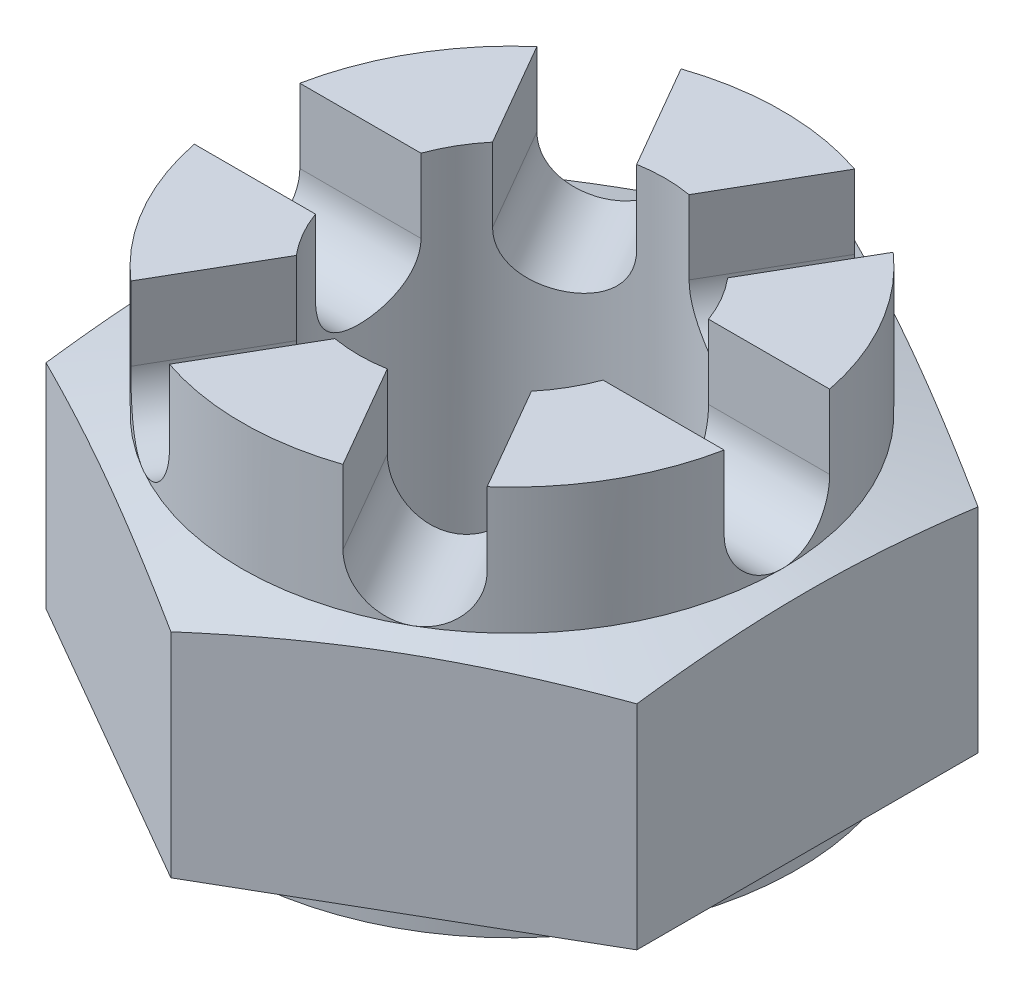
SolidWorks part; units mm, degrees
ref_plane "Спереди" through (0, 0, 0) normal (0, 0, 1) x (1, 0, 0)
ref_plane "Сверху" through (0, 0, 0) normal (0, 1, 0) x (1, 0, 0)
ref_plane "Справа" through (0, 0, 0) normal (1, 0, 0) x (0, 0, -1)
sketch "Эскиз1" plane through (0, 0, 0) normal (0, 1, 0) x (1, 0, 0)
  line L1 (0, 6.4158) -> (-5.5563, 3.2079)
  line L2 (-5.5563, 3.2079) -> (-5.5563, -3.2079)
  line L3 (-5.5563, -3.2079) -> (0, -6.4158)
  line L4 (0, -6.4158) -> (5.5562, -3.2079)
  line L5 (5.5562, -3.2079) -> (5.5562, 3.2079)
  line L6 (5.5562, 3.2079) -> (0, 6.4158)
  circle A0 centre (0, 0) radius 2.8804
  circle A1 centre (0, 0) radius 5.5563 construction
  dimension "D1" = 5.7607
  dimension "D2" = 11.1125
extrude "Бобышка-Вытянуть1" add sketch "Эскиз1" along normal blind 7.1437
sketch "Эскиз2" plane through (0, 0, 0) normal (1, 0, 0) x (0, 0, -1)
  line L0 (0, 0) -> (0, 12.1137) construction
  line L1 (6.4158, 7.1437) -> (3.2079, 7.1437) construction
  line L2 (6.4158, 0) -> (5.3578, 0)
  line L3 (6.4158, 0) -> (6.4158, 0.3969)
  line L4 (6.4158, 0.3969) -> (5.3578, 0.3969)
  line L5 (5.3578, 0) -> (5.3578, 0.3969)
  line L6 (6.4158, 7.1437) -> (5.08, 7.1437)
  line L7 (6.4158, 7.1437) -> (6.4158, 4.4046)
  line L8 (6.4158, 4.4046) -> (5.08, 4.7625)
  line L9 (5.08, 7.1437) -> (5.08, 4.7625)
  line L10 (-3.2079, 0) -> (3.2079, 0) construction
  line L11 (6.4158, 7.1437) -> (6.4158, 0) construction
  dimension "D1" = 0.3969
  dimension "D2" = 10.16
  dimension "D3" = 2.3813
  dimension "D4" = 15
  dimension "D5" = 10.7156
revolve "Вырез-Повернуть1" cut sketch "Эскиз2" angle 360 about L0
sketch "Эскиз3" plane through (0, 0, 0) normal (1, 0, 0) x (0, 0, -1)
  line L0 (5.08, 7.1437) -> (-5.08, 7.1437) construction
  line L1 (0.9922, 7.1437) -> (-0.9922, 7.1437)
  line L2 (0.9922, 7.1437) -> (0.9922, 5.7547)
  line L4 (-0.9922, 7.1437) -> (-0.9922, 5.7547)
  arc A0 (0.9922, 5.7547) -> (-0.9922, 5.7547) centre (0, 5.7547) cw
  point P8 (0, 4.7625)
  dimension "D1" = 1.9844
  dimension "D2" = 2.3813
extrude "Вырез-Вытянуть1" cut sketch "Эскиз3" against normal through all
pattern_circular "Круговой массив1" count 6 over 360 about axis through (0, 0, 0) along (0, 1, 0) of "Вырез-Вытянуть1"
